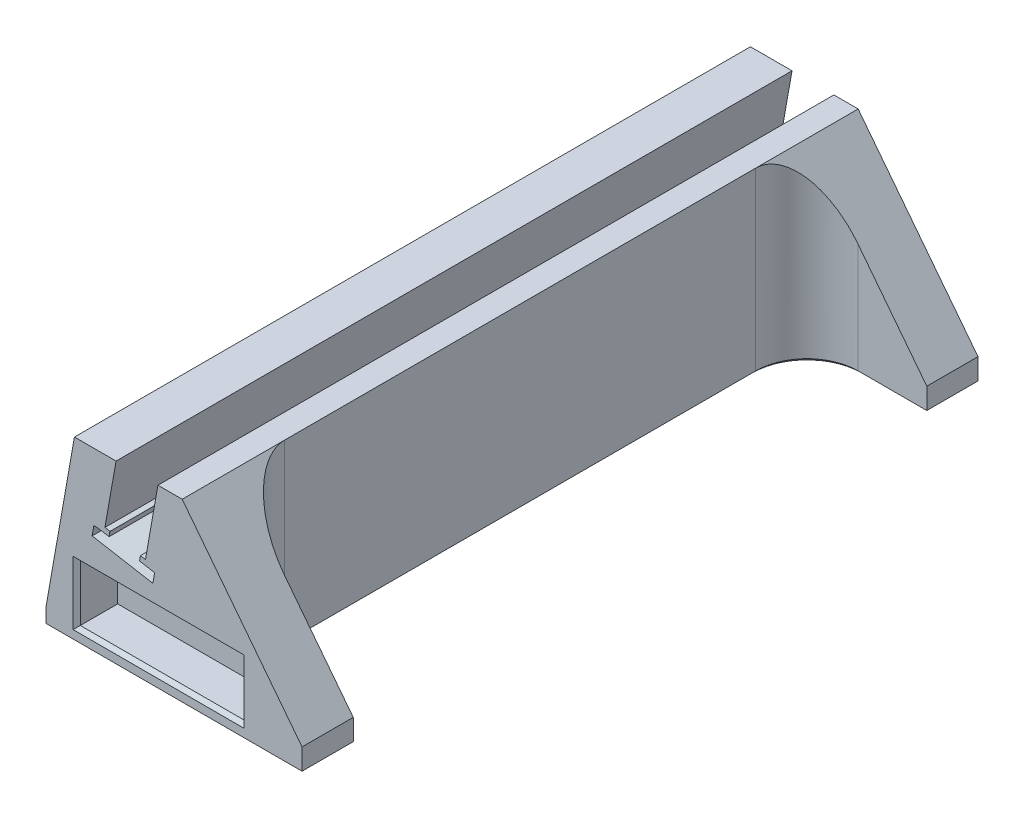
SolidWorks part; units mm, degrees
ref_plane "Front" through (0, 0, 0) normal (0, 0, 1) x (1, 0, 0)
ref_plane "Top" through (0, 0, 0) normal (0, 1, 0) x (1, 0, 0)
ref_plane "Right" through (0, 0, 0) normal (1, 0, 0) x (0, 0, -1)
sketch "Skizze1" plane through (0, 0, 0) normal (0, 0, 1) x (1, 0, 0)
  line L0 (-19.4436, 15) -> (-25, -16.5121)
  line L1 (-19.4436, 15) -> (-11.3202, 15)
  line L2 (-25, -16.5121) -> (-25, -20)
  line L3 (-25, -20) -> (25, -20)
  line L4 (25, -15.1842) -> (25, -20)
  line L5 (-11.3202, 15) -> (-13.4914, 2.6865)
  line L7 (-5.5771, 1.2127) -> (-3.146, 15)
  line L8 (-3.146, 15) -> (1.5959, 15)
  line L9 (-13.665, 1.7017) -> (-15.6466, 1.9728)
  line L10 (-5.7507, 0.2279) -> (-3.7811, -0.1194)
  line L11 (-15.6466, 1.9728) -> (-15.9953, 0.0034)
  line L12 (-3.7811, -0.1194) -> (-4.1284, -2.089)
  line L13 (-15.9953, 0.0034) -> (-4.1284, -2.089)
  line L14 (-13.665, 1.7017) -> (-12.6802, 1.5281)
  line L16 (-12.6802, 1.5281) -> (-12.5066, 2.5129)
  line L17 (-13.4914, 2.6865) -> (-12.5066, 2.5129)
  line L18 (-5.7507, 0.2279) -> (-6.7355, 0.4015)
  line L20 (-6.7355, 0.4015) -> (-6.5619, 1.3863)
  line L21 (-5.5771, 1.2127) -> (-6.5619, 1.3863)
  line L22 (25, -15.1842) -> (1.5959, 15)
  point P13 (-12.5934, 2.0205)
  point P19 (-6.2431, 0.3147)
  dimension "D1" = 50
  dimension "D2" = 35
  dimension "D3" = 15
  dimension "D4" = 25
  dimension "D5" = 10
  dimension "D6" = 8
  dimension "D7" = 8.05
  dimension "D8" = 15
  dimension "D9" = 2
  dimension "D10" = 2
  dimension "D11" = 2
  dimension "D12" = 2
  dimension "D13" = 1
  dimension "D14" = 1
  dimension "D15" = 1
  dimension "D16" = 1
extrude "Aufsatz-Linear austragen1" add sketch "Skizze1" along normal blind 132
sketch "Skizze2" plane through (0, 15, 0) normal (0, 1, 0) x (1, 0, 0)
  line L0 (1.5959, -132) -> (1.5959, 0) construction
  line L1 (25, -132) -> (25, 0) construction
  line L2 (1.5959, -10) -> (25, -10)
  line L3 (1.5959, -10) -> (1.5959, -122)
  line L4 (1.5959, -122) -> (25, -122)
  line L5 (25, -10) -> (25, -122)
  line L6 (25, 0) -> (1.5959, 0) construction
  line L7 (25, -132) -> (1.5959, -132) construction
  dimension "D1" = 10
  dimension "D2" = 10
extrude "Schnitt-Linear austragen1" cut sketch "Skizze2" against normal through all
fillet "Verrundung1" radius 10 2 edges at (1.5959, -2.5, 122) (1.5959, -2.5, 10)
sketch "Skizze3" plane through (0, 0, 132) normal (0, 0, 1) x (1, 0, 0)
  line L0 (-25, -16.5121) -> (-25, -20) construction
  line L1 (-19, -6) -> (13, -6)
  line L2 (-19, -6) -> (-19, -17)
  line L3 (-19, -17) -> (13, -17)
  line L4 (13, -6) -> (13, -17)
  line L5 (25, -20) -> (25, -15.1842) construction
  line L6 (-25, -20) -> (25, -20) construction
  dimension "D1" = 6
  dimension "D2" = 12
  dimension "D3" = 3
  dimension "D4" = 11
extrude "Schnitt-Linear austragen2" cut sketch "Skizze3" against normal blind 8
pattern_linear "Lineares Muster1" count 2 spacing 124 along (0, 0, -1) of "Schnitt-Linear austragen2"
sketch "Skizze4" plane through (0, -20, 0) normal (0, -1, 0) x (1, 0, 0)
  line L0 (-25, 132) -> (25, 132) construction
  line L1 (-21, 121) -> (-2.4041, 121)
  line L2 (-21, 121) -> (-21, 11)
  line L3 (-21, 11) -> (-2.4041, 11)
  line L4 (-2.4041, 121) -> (-2.4041, 11)
  line L5 (-25, 0) -> (25, 0) construction
  line L6 (-25, 132) -> (-25, 0) construction
  line L7 (1.5959, 20) -> (1.5959, 112) construction
  dimension "D1" = 11
  dimension "D2" = 11
  dimension "D3" = 4
  dimension "D4" = 4
extrude "Schnitt-Linear austragen3" cut sketch "Skizze4" against normal blind 12
chamfer "Fase1" distance 0.7 angle 45 22 edges at (-3, -17, 132) (13, -11.5, 132) (-19, -11.5, 132) (-3, -6, 132) (-19, -11.5, 0) (-3, -17, 0) (13, -11.5, 0) (-3, -6, 0) (0, -20, 0) (-25, -20, 66) (0, -20, 132) (25, -20, 127) (18.298, -20, 122) (4.5249, -20, 119.0711) (1.5959, -20, 66) (4.5249, -20, 12.9289) (18.298, -20, 10) (25, -20, 5) (-2.4041, -20, 66) (-11.702, -20, 121) (-21, -20, 66) (-11.702, -20, 11)
